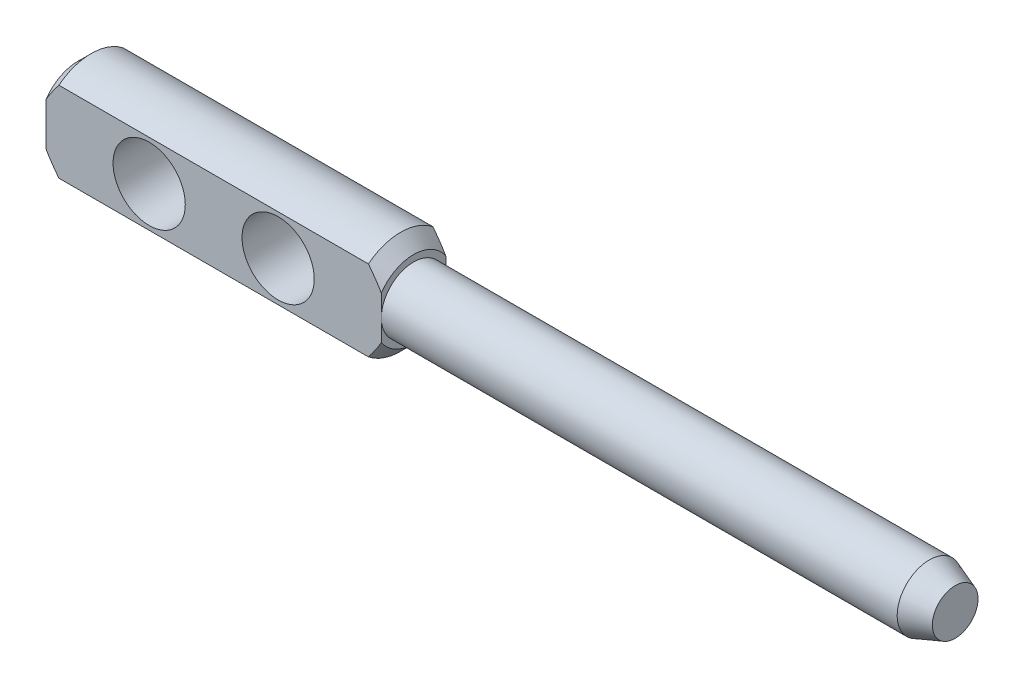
SolidWorks part; units mm, degrees
ref_plane "Front Plane" through (0, 0, 0) normal (0, 0, 1) x (1, 0, 0)
ref_plane "Top Plane" through (0, 0, 0) normal (0, 1, 0) x (1, 0, 0)
ref_plane "Right Plane" through (0, 0, 0) normal (1, 0, 0) x (0, 0, -1)
sketch "Sketch1" plane through (0, 0, 0) normal (0, 0, 1) x (1, 0, 0)
  line L0 (0, 0) -> (34, 0) construction
  line L1 (0, 0) -> (0, 1.5)
  line L2 (0.5, 2) -> (12.5, 2)
  line L3 (13, 1.5) -> (13, 1.25)
  line L4 (13, 1.25) -> (33, 1.25)
  line L5 (33, 1.25) -> (34, 0.886)
  line L6 (34, 0.886) -> (34, 0)
  line L7 (0, 1.5) -> (0.5, 2)
  line L8 (12.5, 2) -> (13, 1.5)
  line L9 (0, 0) -> (34, 0)
  point P4 (0, 2)
  point P5 (13, 2)
  dimension "D1" = 4
  dimension "D2" = 2.5
  dimension "D3" = 1
  dimension "L1" = 13
  dimension "L2" = 21
  dimension "D4" = 20
revolve "Revolve1" add sketch "Sketch1" angle 360 about L0
sketch "Sketch2" plane through (0, 0, 0) normal (-1, 0, 0) x (0, 0, 1)
  line L1 (-1.25, -2) -> (1.25, -2)
  line L2 (-1.25, -2) -> (-1.25, 2)
  line L3 (-1.25, 2) -> (1.25, 2)
  line L4 (1.25, -2) -> (1.25, 2)
  line L5 (-1.25, -2) -> (1.25, 2) construction
  line L6 (-1.25, 2) -> (1.25, -2) construction
  circle A0 centre (0, 0) radius 2 construction
  point P0 (0, 0)
  dimension "E" = 2.5
extrude "Cut-Extrude1" cut sketch "Sketch2" against normal blind 19 flip side to cut
sketch "Sketch4" plane through (0, 0, 1.25) normal (0, 0, 1) x (1, 0, 0)
  circle A0 centre (4, 0) radius 1.4
  circle A1 centre (9, 0) radius 1.4
  dimension "D1" = 2.8
  dimension "F1" = 2.8
  dimension "D2" = 5
  dimension "H1" = 4
extrude "Cut-Extrude2" cut sketch "Sketch4" against normal through all
